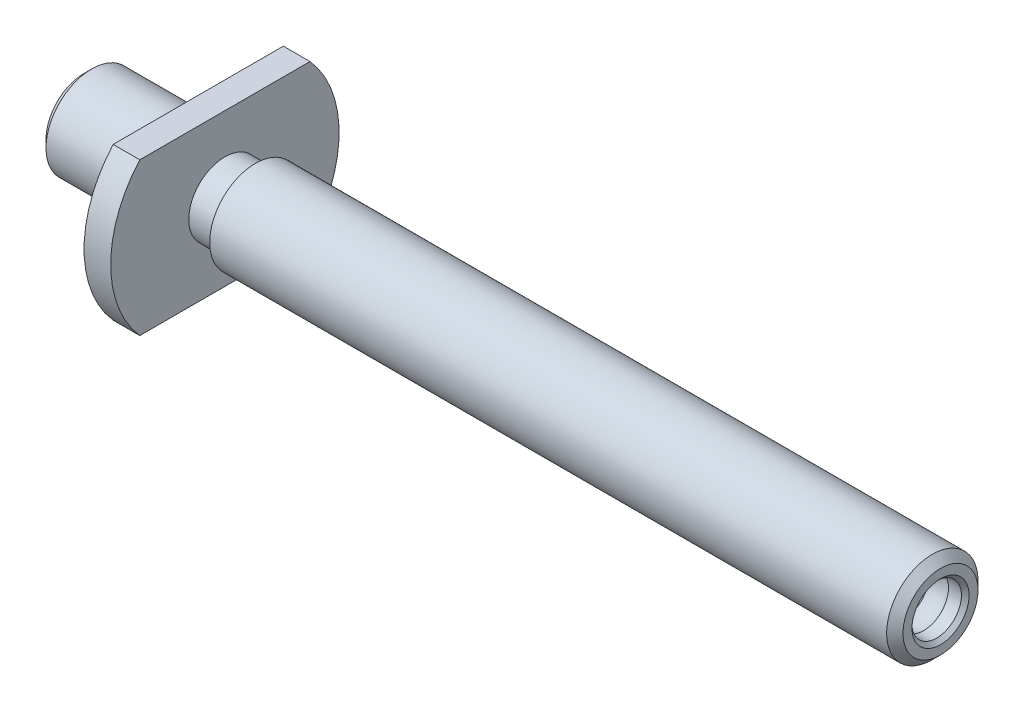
SolidWorks part; units mm, degrees
ref_plane "Face" through (0, 0, 0) normal (0, 0, 1) x (1, 0, 0)
ref_plane "Dessus" through (0, 0, 0) normal (0, 1, 0) x (1, 0, 0)
ref_plane "Droite" through (0, 0, 0) normal (1, 0, 0) x (0, 0, -1)
sketch "Esquisse1" plane through (0, 0, 0) normal (0, 0, 1) x (1, 0, 0)
  line L0 (-15, 0) -> (89.9168, 0)
  line L1 (97.5, 3.75) -> (97.5, 4.9265)
  line L2 (96.4265, 6) -> (7.5, 6)
  line L3 (3.5, 4.75) -> (3.5, 15)
  line L4 (3.5, 15) -> (0, 15)
  line L5 (0, 15) -> (0, 6)
  line L6 (0, 6) -> (-15, 6)
  line L7 (-15, 6) -> (-15, 0)
  line L8 (110.6665, 0) -> (-40.1567, 0) construction
  line L9 (97.5, 4.9265) -> (96.4265, 6)
  line L10 (97, 3.25) -> (95.299, 3.25)
  line L11 (92.701, 3.25) -> (91.8696, 3.25)
  line L12 (3.5, 4.75) -> (7.5, 4.75)
  line L13 (7.5, 4.75) -> (7.5, 6)
  line L14 (91.8696, 3.25) -> (89.9168, 0)
  line L15 (97.5, 3.75) -> (97, 3.25)
  arc A0 (95.299, 3.25) -> (92.701, 3.25) centre (94, 0) ccw
  point P12 (97.5, 3.25)
  point P13 (97.5, 6)
  dimension "D7" = 3.25
  dimension "D10" = 7
  dimension "D1" = 6
  dimension "D2" = 15
  dimension "D3" = 15
  dimension "D4" = 3.5
  dimension "D5" = 6
  dimension "D6" = 97.5
  dimension "D8" = 59
  dimension "D9" = 1.0734
  dimension "D11" = 3.5
  dimension "D12" = 4
  dimension "D13" = 4.75
  dimension "D16" = 0.5
revolve "Forme de révolution" add sketch "Esquisse1" angle 360 about L8
chamfer "Chanfrein2" distance 1 angle 45 1 edges at (-15, 0, -6)
sketch "Esquisse3" plane through (3.5, 0, 0) normal (1, 0, 0) x (0, 0, -1)
  line L0 (-15.2232, 10) -> (13.535, 10)
  dimension "D1" = 10
extrude "Méplats" cut sketch "Esquisse3" against normal through all and the other way through all
mirror "Symétrie1" about plane through (0, 0, 0) normal (0, 1, 0) of "Méplats"
sketch "Esquisse2" plane through (97.5, 0, 0) normal (1, 0, 0) x (0, 0, -1)
  line L0 (0, -6.5827) -> (0, 6.5827) construction
  circle A0 centre (0, 0) radius 6 construction
  circle A1 centre (0, 0) radius 6
sketch "Esquisse5" plane through (0, 0, 0) normal (0, 0, 1) x (1, 0, 0)
  line L0 (97.5, -6.5827) -> (97.5, 6.5827) construction
  line L1 (97.5, -6.5827) -> (97.5, 6.5827) construction
  line L2 (96.625, 6.1894) -> (98.375, 6.1894) construction
  line L3 (98.2803, 6.0254) -> (97.7187, 5.0527)
  line L4 (97.2813, 5.0527) -> (96.7197, 6.0254)
  line L5 (97.5, 0) -> (101.0142, 0) construction
  line L6 (96.7197, 6.0254) -> (98.2803, 6.0254)
  arc A0 (97.7187, 5.0527) -> (97.2813, 5.0527) centre (97.5, 5.1789) cw
  dimension "D5" = 0.2525
  dimension "D1" = 60
  dimension "D2" = 6.1894
  dimension "D3" = 1.75
  dimension "D4" = 0.1641
